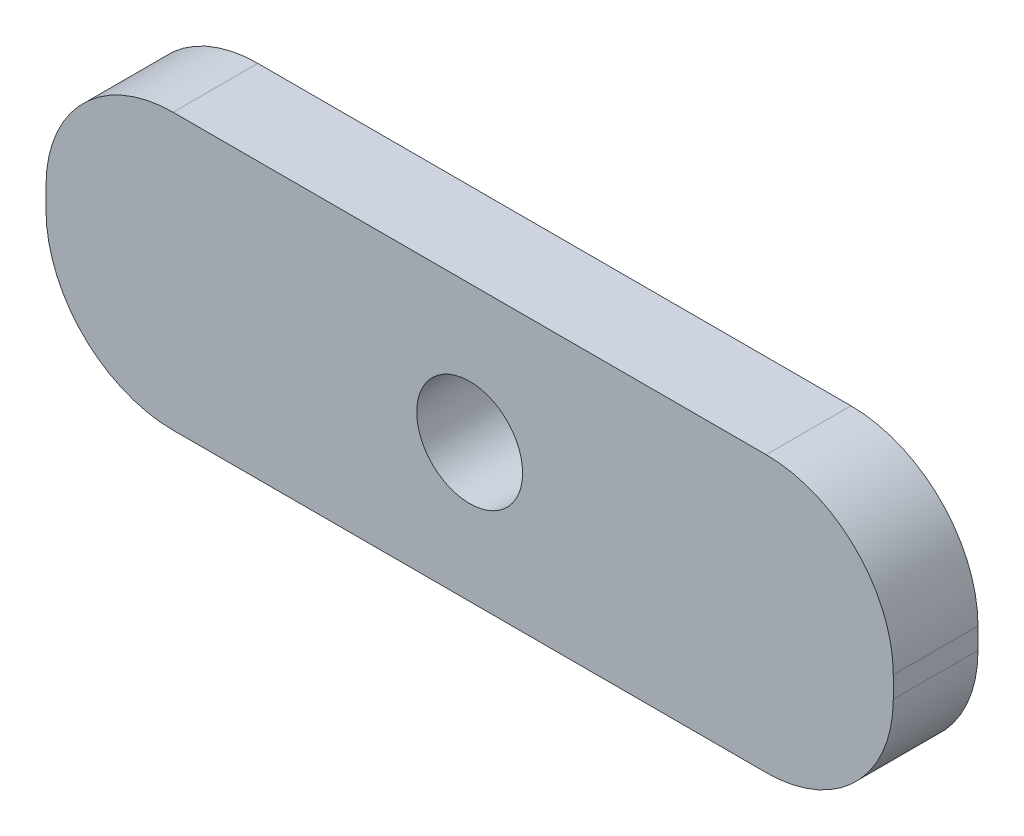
SolidWorks part; units mm, degrees
ref_plane "Plan de face" through (0, 0, 0) normal (0, 0, 1) x (1, 0, 0)
ref_plane "Plan de dessus" through (0, 0, 0) normal (0, 1, 0) x (1, 0, 0)
ref_plane "Plan de droite" through (0, 0, 0) normal (1, 0, 0) x (0, 0, -1)
sketch "Esquisse1" plane through (0, 0, 0) normal (0, 0, 1) x (1, 0, 0)
  line L0 (-43.9635, 0) -> (-15.9635, 0)
  line L1 (-43.9635, 13) -> (-15.9635, 13)
  line L2 (-9.9635, 7) -> (-9.9635, 6)
  line L3 (-49.9635, 6) -> (-49.9635, 7)
  arc A0 (-43.9635, 0) -> (-49.9635, 6) centre (-43.9635, 6) cw
  arc A1 (-49.9635, 7) -> (-43.9635, 13) centre (-43.9635, 7) cw
  arc A2 (-15.9635, 13) -> (-9.9635, 7) centre (-15.9635, 7) cw
  arc A3 (-15.9635, 0) -> (-9.9635, 6) centre (-15.9635, 6) ccw
  circle A4 centre (-29.9635, 6.5) radius 2.5
  point P3 (-15.9635, 6)
  point P10 (-15.9635, 7)
  point P15 (-30.7979, 6.5)
extrude "Boss.-Extru.2" add sketch "Esquisse1" along normal blind 4
